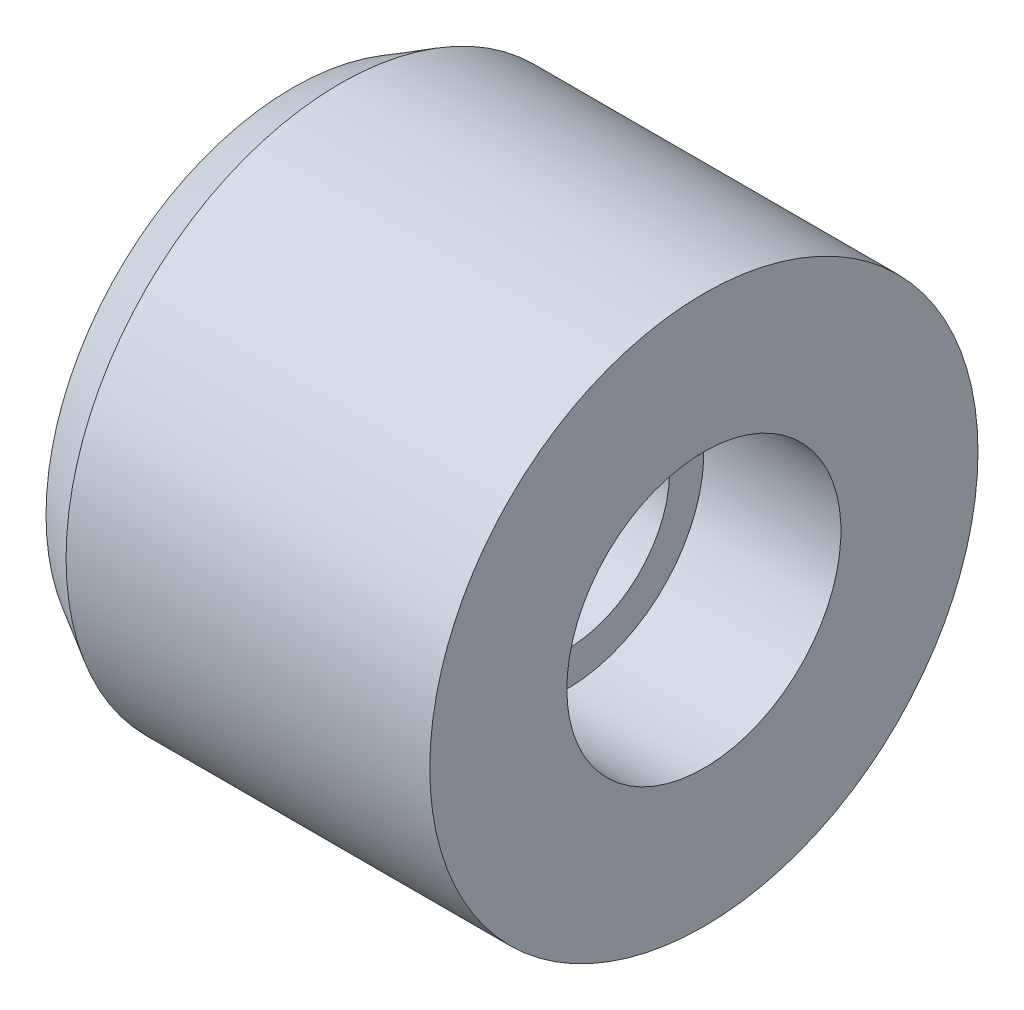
SolidWorks part; units mm, degrees
ref_plane "Plan de face" through (0, 0, 0) normal (0, 0, 1) x (1, 0, 0)
ref_plane "Plan de dessus" through (0, 0, 0) normal (0, 1, 0) x (1, 0, 0)
ref_plane "Plan de droite" through (0, 0, 0) normal (1, 0, 0) x (0, 0, -1)
sketch "Esquisse1" plane through (0, 0, 0) normal (0, 0, 1) x (1, 0, 0)
  line L0 (-17.9482, 0) -> (30.3974, 0) construction
  line L1 (0, 0) -> (0, 3.6)
  line L2 (0, 3.6) -> (0.6928, 4)
  line L3 (0.6928, 4) -> (6, 4)
  line L4 (6, 4) -> (6, 2)
  line L5 (6, 2) -> (4, 2)
  line L6 (4, 2) -> (4, 1.5)
  line L7 (4, 1.5) -> (3, 1.5)
  line L8 (3, 1.5) -> (3, 2)
  line L9 (3, 2) -> (1, 2)
  line L10 (1, 2) -> (1, 0)
  line L11 (1, 0) -> (0, 0)
  dimension "D1" = 2
  dimension "D2" = 0.5
  dimension "D3" = 2
  dimension "D4" = 6
  dimension "D5" = 1
  dimension "D6" = 2
  dimension "D7" = 1
  dimension "D8" = 0.5
  dimension "D9" = 4
  dimension "D10" = 3.6
  dimension "D11" = 60
revolve "Révolution1" add sketch "Esquisse1" angle 360 about L0
